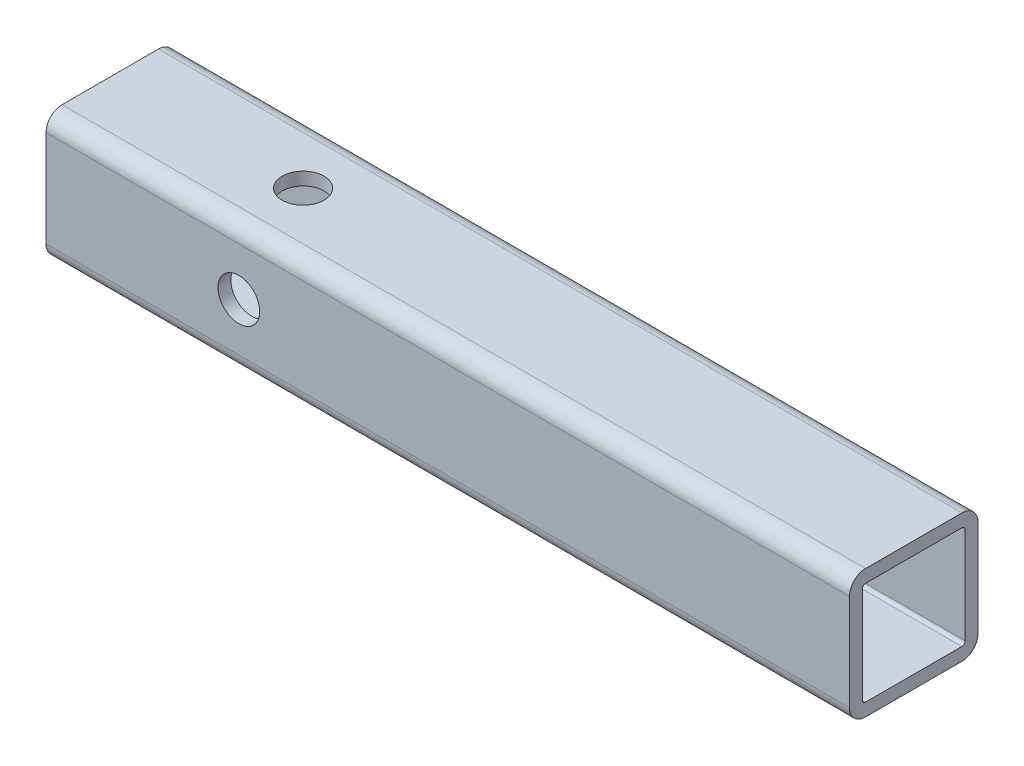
SolidWorks part; units mm, degrees
ref_plane "Plan1" through (0, 0, 0) normal (0, 0, 1) x (1, 0, 0)
ref_plane "Plan2" through (0, 0, 0) normal (0, 1, 0) x (1, 0, 0)
ref_plane "Plan3" through (0, 0, 0) normal (1, 0, 0) x (0, 0, -1)
sketch "Esquisse1" plane through (0, 0, 0) normal (1, 0, 0) x (0, 0, -1)
  line L0 (-4, -5) -> (-4, -35)
  line L1 (-5, 0) -> (-35, 0)
  line L2 (0, -5) -> (0, -35)
  line L3 (-5, -40) -> (-35, -40)
  line L4 (-40, -5) -> (-40, -35)
  line L5 (-5, -36) -> (-35, -36)
  line L6 (-36, -5) -> (-36, -35)
  line L7 (-5, -4) -> (-35, -4)
  arc A0 (0, -5) -> (-5, 0) centre (-5, -5) ccw
  arc A1 (-5, -40) -> (0, -35) centre (-5, -35) ccw
  arc A2 (-40, -35) -> (-35, -40) centre (-35, -35) ccw
  arc A3 (-35, 0) -> (-40, -5) centre (-35, -5) ccw
  arc A4 (-5, -36) -> (-4, -35) centre (-5, -35) ccw
  arc A5 (-36, -35) -> (-35, -36) centre (-35, -35) ccw
  arc A6 (-35, -4) -> (-36, -5) centre (-35, -5) ccw
  arc A7 (-4, -5) -> (-5, -4) centre (-5, -5) ccw
  point P6 (0, 0)
  point P9 (0, -40)
  point P15 (-40, 0)
  dimension "D1" = 40
  dimension "D3" = 5
  dimension "D4" = 4
  dimension "D2" = 40
extrude "Base-Extrusion" add sketch "Esquisse1" along normal blind 250
sketch "Esquisse4" plane through (0, 0, 40) normal (0, 0, 1) x (1, 0, 0)
  line L0 (0, -5) -> (0, -35) construction
  line L1 (250, 0) -> (0, 0) construction
  circle A0 centre (60, -20) radius 6.5
  dimension "D1" = 13
  dimension "D2" = 60
  dimension "D3" = 20
extrude "Enlèv. mat.-Extru.3" cut sketch "Esquisse4" against normal through all
sketch "Esquisse5" plane through (0, -40, 0) normal (0, -1, 0) x (1, 0, 0)
  line L0 (0, 35) -> (0, 5) construction
  line L1 (250, 40) -> (0, 40) construction
  circle A0 centre (60, 20) radius 6.5
  dimension "D1" = 13
  dimension "D2" = 60
  dimension "D3" = 20
extrude "Enlèv. mat.-Extru.4" cut sketch "Esquisse5" against normal through all
